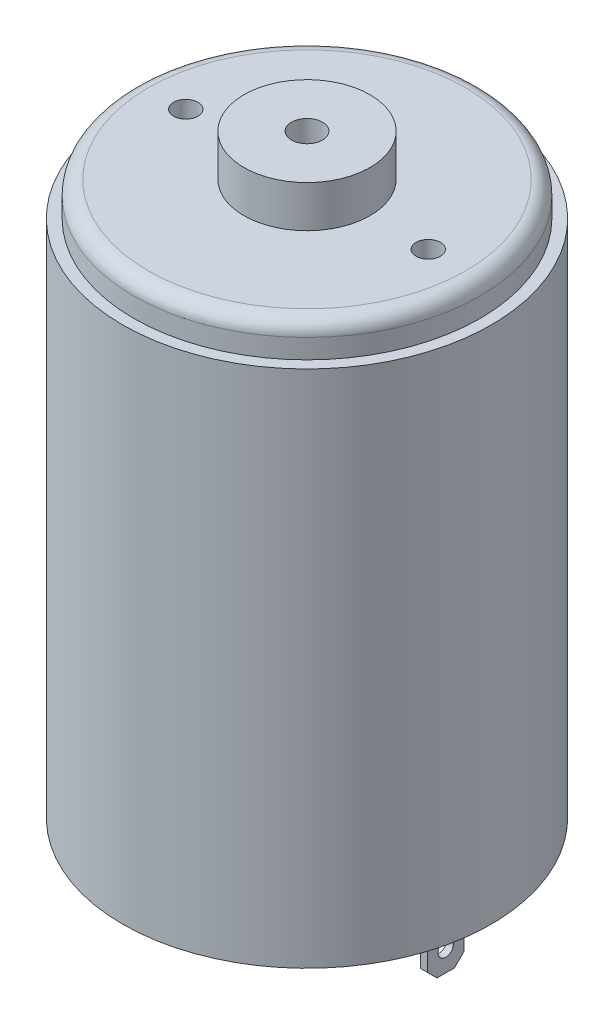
SolidWorks part; units mm, degrees
ref_plane "Plan de face" through (0, 0, 0) normal (0, 0, 1) x (1, 0, 0)
ref_plane "Plan de dessus" through (0, 0, 0) normal (0, 1, 0) x (1, 0, 0)
ref_plane "Plan de droite" through (0, 0, 0) normal (1, 0, 0) x (0, 0, -1)
sketch "Esquisse1" plane through (0, 0, 0) normal (0, 0, 1) x (1, 0, 0)
  line L0 (0, 0) -> (0, 85) construction
  line L1 (0, 0) -> (-1.6, 0)
  line L2 (-1.6, 0) -> (-1.6, 2.6)
  line L3 (-1.6, 2.6) -> (-5.075, 2.6)
  line L4 (-5.075, 2.6) -> (-5.075, 4.5)
  line L5 (-5.075, 4.5) -> (-19, 4.5)
  line L6 (-19, 4.5) -> (-19, 58)
  line L7 (-19, 58) -> (-17.85, 58)
  line L8 (-17.85, 58) -> (-17.85, 60)
  line L9 (-16.35, 61.5) -> (-6.5, 61.5)
  line L10 (-6.5, 61.5) -> (-6.5, 65.8)
  line L11 (-6.5, 65.8) -> (-1.6, 65.8)
  line L12 (-1.6, 65.8) -> (-1.6, 85)
  line L13 (-1.6, 85) -> (0, 85)
  line L14 (0, 0) -> (0, 85)
  arc A0 (-17.85, 60) -> (-16.35, 61.5) centre (-16.35, 60) cw
  dimension "D13" = 1.5
  dimension "D1" = 3.2
  dimension "D2" = 2.6
  dimension "D3" = 10.15
  dimension "D4" = 4.5
  dimension "D5" = 38
  dimension "D6" = 53.5
  dimension "D7" = 35.7
  dimension "D8" = 57
  dimension "D9" = 13
  dimension "D10" = 4.3
  dimension "D11" = 3.2
  dimension "D12" = 85
revolve "Révolution1" add sketch "Esquisse1" angle 360 about L0
sketch "Esquisse2" plane through (0, 85, 0) normal (0, 1, 0) x (1, 0, 0)
  line L0 (-1.1619, -1.1) -> (1.1619, -1.1)
  circle A1 centre (0, 0) radius 1.6
  arc A2 (-1.1619, -1.1) -> (1.1619, -1.1) centre (0, 0) ccw
  dimension "D2" = 1.1
  dimension "D1" = 0
extrude "Enlèv. mat.-Extru.1" cut sketch "Esquisse2" against normal blind 15
hole_wizard "Trou taraudé M31" positions "Esquisse4" profile "Esquisse3" tap size "M3" standard "ISO"
sketch "Esquisse4" plane through (0, 61.5, 0) normal (0, 1, 0) x (-1, 0, 0)
  point P0 (12.5, 0)
  point P1 (-12.5, 0)
  dimension "D1" = 25
  dimension "D2" = 12.5
sketch "Esquisse3" plane through (-12.5, 61.5, 0) normal (1, 0, 0) x (0, 0, 1)
  line L0 (0, 0) -> (0, 9.2511)
  line L1 (0, 9.2511) -> (1.25, 8.5)
  line L2 (1.25, 8.5) -> (1.25, 0)
  line L5 (1.25, 0) -> (0, 0)
  line L10 (0, 9.2511) -> (-1.25, 8.5) construction
  line L11 (0, -6.35) -> (0, 107.95) construction
  dimension "Diamètre du trou pour taraudage" = 2.5
  dimension "Profondeur du trou pour taraudage" = 8.5
  dimension "Angle de pointe" = 118
sketch "Esquisse5" plane through (0, 4.5, 0) normal (0, -1, 0) x (1, 0, 0)
  line L1 (-14.3, 1.9) -> (-13.6, 1.9)
  line L2 (-14.3, 1.9) -> (-14.3, -1.9)
  line L3 (-14.3, -1.9) -> (-13.6, -1.9)
  line L4 (-13.6, 1.9) -> (-13.6, -1.9)
  dimension "D1" = 14.3
  dimension "D2" = 0.7
  dimension "D3" = 3.8
  dimension "D4" = 1.9
extrude "Boss.-Extru.1" add sketch "Esquisse5" along normal blind 6.7
chamfer "Chanfrein1" distance 1 angle 45 2 edges at (-13.95, -2.2, 1.9) (-13.95, -2.2, -1.9)
sketch "Esquisse6" plane through (-14.3, 0, 0) normal (-1, 0, 0) x (0, 0, 1)
  circle A0 centre (0, 0) radius 0.8
  dimension "D1" = 1.6
extrude "Enlèv. mat.-Extru.2" cut sketch "Esquisse6" against normal blind 6.7
pattern_circular "Répétition circulaire1" count 2 over 360 about axis through (0, 0, 0) along (0, 1, 0) of "Enlèv. mat.-Extru.2", "Boss.-Extru.1", "Chanfrein1"
sketch "Esquisse7" plane through (0, 0, 0) normal (0, -1, 0) x (1, 0, 0)
  circle A1 centre (0, 0) radius 1.6
  circle A2 centre (0, 0) radius 1.6
  dimension "D1" = 0
extrude "Enlèv. mat.-Extru.3" cut sketch "Esquisse7" against normal through all
